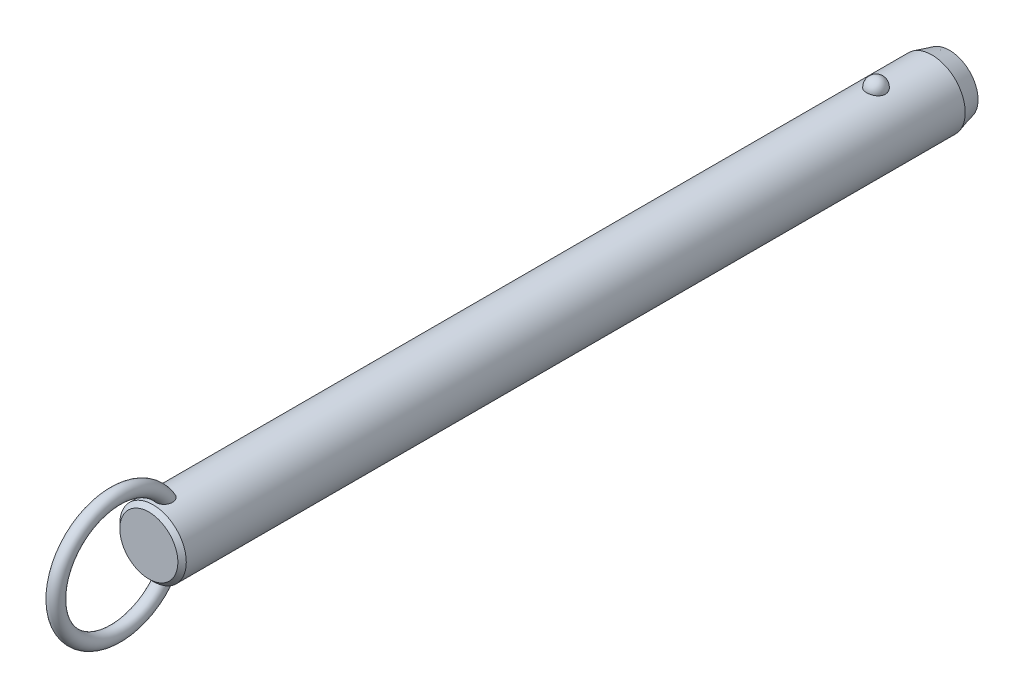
SolidWorks part; units mm, degrees
ref_plane "Front Plane" through (0, 0, 0) normal (0, 0, 1) x (1, 0, 0)
ref_plane "Top Plane" through (0, 0, 0) normal (0, 1, 0) x (1, 0, 0)
ref_plane "Right Plane" through (0, 0, 0) normal (1, 0, 0) x (0, 0, -1)
sketch "Sketch2" plane through (0, 0, 0) normal (0, 0, 1) x (1, 0, 0)
  circle A0 centre (0, 0) radius 9.5
  point P3 (0, 9.5)
  dimension "D1" = 19
extrude "Boss-Extrude1" add sketch "Sketch2" along normal blind 195.6
sketch "Sketch3" plane through (0, 0, 0) normal (0, 0, -1) x (-1, 0, 0)
  circle A0 centre (0, 0) radius 9.5
  dimension "D1" = 19
extrude "Boss-Extrude2" add sketch "Sketch3" along normal blind 23.7
chamfer "Chamfer1" distance 5 angle 15 1 edges at (-9.5, 0, -23.7)
sketch "Sketch12" plane through (0, 0, 0) normal (1, 0, 0) x (0, 0, -1)
  line L0 (-195.6, 9.5) -> (-195.6, -9.5) construction
  point P0 (-195.6, 0)
sketch "Sketch13" plane through (0, 0, 0) normal (1, 0, 0) x (0, 0, -1)
  circle A0 centre (-214.65, 0) radius 19.05
  point P2 (-195.6, 0)
  dimension "D1" = 38.1
sketch "Sketch14" plane through (0, 0, 0) normal (0, 1, 0) x (1, 0, 0)
  circle A0 centre (0, -197.6) radius 2
  point P2 (0, -195.6)
  dimension "D1" = 4
sweep "Sweep1" add profiles "Sketch14" path "Sketch13"
sketch "Sketch15" plane through (0, 0, 195.6) normal (0, 0, 1) x (1, 0, 0)
  circle A0 centre (0, 0) radius 9.5
  dimension "D1" = 19
extrude "Boss-Extrude3" add sketch "Sketch15" along normal blind 9.52
chamfer "Chamfer2" distance 1.2 angle 45 1 edges at (9.5, 0, 205.12)
sketch "Sketch18" plane through (0, 0, 0) normal (1, 0, 0) x (0, 0, -1)
  line L0 (18.7, 9.5) -> (-198.1378, 9.5) construction
  line L1 (2.7, 12.2) -> (2.7, 6.8)
  line L2 (-198.1378, -9.5) -> (18.7, -9.5) construction
  arc A0 (2.7, 12.2) -> (2.7, 6.8) centre (2.7, 9.5) ccw
  point P4 (0, 9.5)
  dimension "D1" = 21.7
revolve "Revolve1" add sketch "Sketch18" angle 360 about L1
